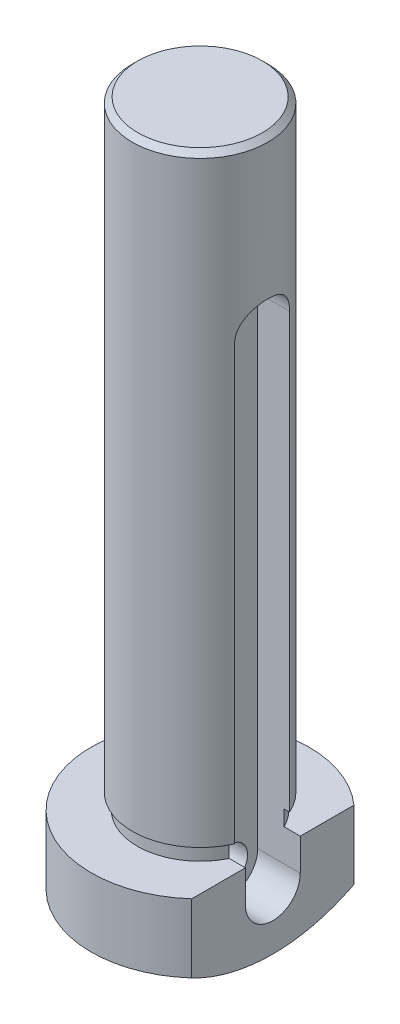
SolidWorks part; units mm, degrees
ref_plane "front" through (0, 0, 0) normal (0, 0, 1) x (1, 0, 0)
ref_plane "top" through (0, 0, 0) normal (0, 1, 0) x (1, 0, 0)
ref_plane "side" through (0, 0, 0) normal (1, 0, 0) x (0, 0, -1)
sketch "Sketch1" plane through (0, 0, 0) normal (0, 0, 1) x (1, 0, 0)
  line L0 (5.0419, 1.5875) -> (5.0419, 4.7625)
  line L1 (5.0419, 4.7625) -> (2.9083, 4.7625)
  line L2 (2.9083, 4.7625) -> (2.9083, 5.4737)
  line L3 (2.9083, 5.4737) -> (3.1369, 5.4737)
  line L4 (3.1369, 5.4737) -> (3.1369, 33.3502)
  line L5 (3.1369, 33.3502) -> (0, 33.3502)
  line L6 (0, -50) -> (0, 50) construction
  line L7 (0, 33.3502) -> (0, 0)
  line L8 (0, 0) -> (-11.9646, 0) construction
  line L9 (50, 0) -> (-50, 0) construction
  line L10 (0, 0) -> (0, -53.5022) construction
  arc A0 (0, 0) -> (5.0419, 1.5875) centre (0, 8.8003) ccw
  dimension "D1" = 4.7625
  dimension "D2" = 0.7112
  dimension "D3" = 33.3502
  dimension "D4" = 6.2738
  dimension "D5" = 10.0838
  dimension "D6" = 5.8166
  dimension "D7" = 3.175
revolve "Revolve1" add sketch "Sketch1" angle 360 about L10
ref_plane "Plane1" through (1.397, 0, 0) normal (1, 0, 0) x (0, 0, -1)
sketch "Sketch3" plane through (1.397, 0, 0) normal (1, 0, 0) x (0, 0, -1)
  line L0 (0, 1.5875) -> (0, 34.2941) construction
  line L1 (-5.0419, 1.5875) -> (5.0419, 1.5875) construction
  line L2 (0, 25.5524) -> (0, 3.2766) construction
  line L3 (1.27, 25.5524) -> (1.27, 3.2766)
  line L4 (-1.27, 25.5524) -> (-1.27, 3.2766)
  line L5 (3.1369, 33.3502) -> (-3.1369, 33.3502) construction
  arc A0 (1.27, 25.5524) -> (-1.27, 25.5524) centre (0, 25.5524) ccw
  arc A1 (-1.27, 3.2766) -> (1.27, 3.2766) centre (0, 3.2766) ccw
  point P7 (0, 14.4145)
  point P14 (0, 26.8224)
  dimension "D2" = 24.8158
  dimension "D1" = 2.54
  dimension "D3" = 6.5278
extrude "Cut-Extrude1" cut sketch "Sketch3" along normal blind 5.08
sketch "Sketch4" plane through (0, 33.3502, 0) normal (0, 1, 0) x (1, 0, 0)
  line L0 (-5.0419, 0) -> (-5.0419, 4.6361) construction
  line L1 (6.5345, 5.6901) -> (3.3655, 5.6901)
  line L2 (6.5345, 5.6901) -> (6.5345, -6.4112)
  line L3 (6.5345, -6.4112) -> (3.3655, -6.4112)
  line L4 (3.3655, 5.6901) -> (3.3655, -6.4112)
  arc A0 (4.8793, 1.27) -> (4.8793, -1.27) centre (0, 0) ccw construction
  dimension "D1" = 8.4074
extrude "Cut-Extrude2" cut sketch "Sketch4" against normal blind 38.1
sketch "Sketch5" plane through (1.397, 0, 0) normal (1, 0, 0) x (0, 0, -1)
  circle A0 centre (0, 25.5524) radius 0.8001
  circle A1 centre (0, 3.2766) radius 0.8001
  dimension "D1" = 1.6002
extrude "Cut-Extrude3" cut sketch "Sketch5" against normal blind 1.3716
sketch "Sketch6" plane through (0.0254, 0, 0) normal (1, 0, 0) x (0, 0, -1)
  circle A1 centre (0, 25.5524) radius 0.8001
  circle A2 centre (0, 25.5524) radius 0.8001
  dimension "D1" = 0
extrude "Cut-Extrude4" cut sketch "Sketch6" against normal blind 8.9916
chamfer "Chamfer1" distance 0.254 angle 45 1 edges at (0, 33.3502, 3.1369)
